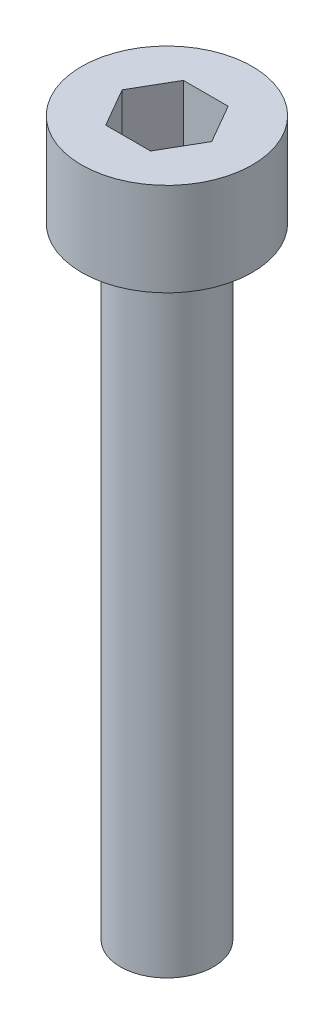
SolidWorks part; units mm, degrees
ref_plane "Front" through (0, 0, 0) normal (0, 0, 1) x (1, 0, 0)
ref_plane "Top" through (0, 0, 0) normal (0, 1, 0) x (1, 0, 0)
ref_plane "Right" through (0, 0, 0) normal (1, 0, 0) x (0, 0, -1)
sketch "profiile" plane through (0, 0, 0) normal (0, 0, 1) x (1, 0, 0)
  line L0 (0, 9.9072) -> (0, -20.7151) construction
  line L1 (0, 3) -> (2.75, 3)
  line L2 (2.75, 3) -> (2.75, 0)
  line L3 (2.75, 0) -> (1.5, 0)
  line L4 (1.5, 0) -> (1.5, -20)
  line L5 (1.5, -20) -> (0, -20)
  line L6 (0, -20) -> (0, 3)
  dimension "D1" = 5.5
  dimension "D2" = 3
  dimension "thread_length" = 20
  dimension "D4" = 3
revolve "Base-Revolve" add sketch "profiile" angle 360 about L0
sketch "Sketch1" plane through (0, 3, 0) normal (0, 1, 0) x (1, 0, 0)
  line L1 (1.4434, 0) -> (0.7217, 1.25)
  line L2 (0.7217, 1.25) -> (-0.7217, 1.25)
  line L3 (-0.7217, 1.25) -> (-1.4434, 0)
  line L4 (-1.4434, 0) -> (-0.7217, -1.25)
  line L5 (-0.7217, -1.25) -> (0.7217, -1.25)
  line L6 (0.7217, -1.25) -> (1.4434, 0)
  circle A0 centre (0, 0) radius 1.25 construction
  dimension "D1" = 2.5
extrude "Cut-Extrude1" cut sketch "Sketch1" against normal blind 2.5
